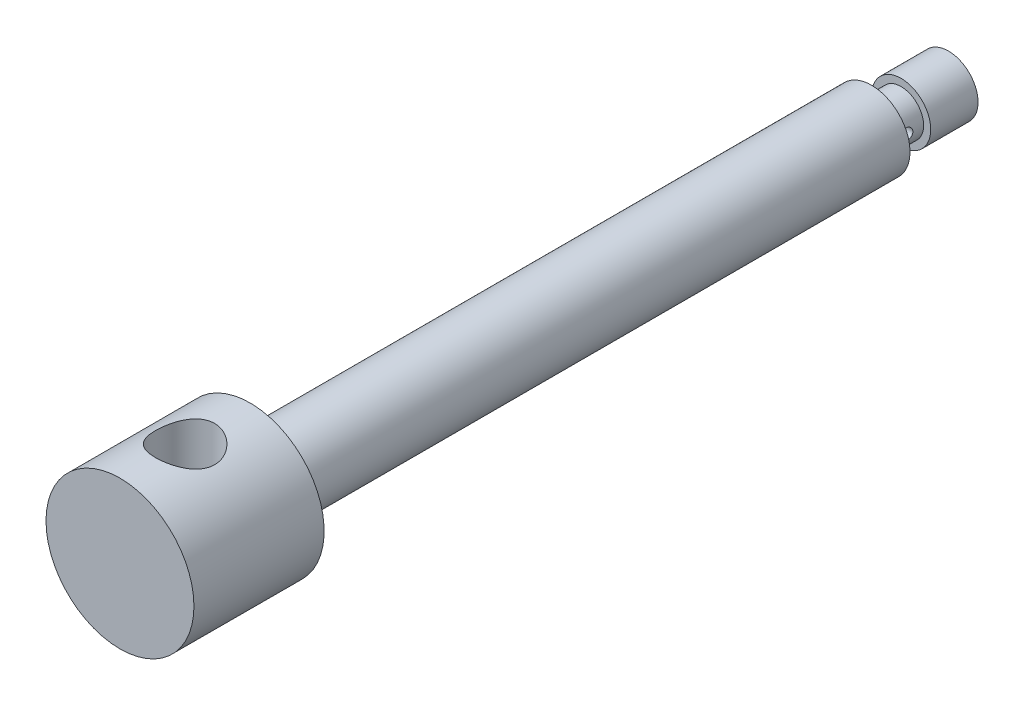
SolidWorks part; units mm, degrees
ref_plane "Front Plane" through (0, 0, 0) normal (0, 0, 1) x (1, 0, 0)
ref_plane "Top Plane" through (0, 0, 0) normal (0, 1, 0) x (1, 0, 0)
ref_plane "Right Plane" through (0, 0, 0) normal (1, 0, 0) x (0, 0, -1)
sketch "Sketch1" plane through (0, 0, 0) normal (0, 0, 1) x (1, 0, 0)
  circle A0 centre (0, 0) radius 12.5
  dimension "D1" = 25
extrude "Boss-Extrude1" add sketch "Sketch1" along normal blind 140
sketch "Sketch2" plane through (0, 0, 0) normal (0, 1, 0) x (1, 0, 0)
  line L0 (0, 0) -> (0, -50000) construction
  line L1 (12.5, 0) -> (-12.5, 0) construction
  line L3 (5, 0) -> (5, -8)
  line L4 (5, -8) -> (3.8, -8)
  line L5 (3.8, -8) -> (3.8, -13)
  line L6 (3.8, -13) -> (6.5, -13)
  line L7 (6.5, -13) -> (6.5, -115)
  line L8 (6.5, -115) -> (3.8, -115)
  line L9 (3.8, -115) -> (3.8, -118)
  line L11 (3.8, -118) -> (14.4791, -118)
  line L12 (14.4791, -118) -> (14.4791, 0)
  line L13 (14.4791, 0) -> (5, 0)
  point P4 (0, 0)
  dimension "D2" = 8
  dimension "D3" = 5
  dimension "D4" = 102
  dimension "D5" = 3
  dimension "D6" = 6.5
  dimension "D7" = 1.2
revolve "Cut-Revolve2" cut sketch "Sketch2" angle 360 about L0
sketch "Sketch3" plane through (0, 0, 0) normal (0, 1, 0) x (1, 0, 0)
  line L0 (-12.5, -140) -> (12.5, -140) construction
  line L1 (0, -129) -> (0, 49871) construction
  line L2 (-12.5, -118) -> (-12.5, -140) construction
  circle A0 centre (0, -129) radius 5
  dimension "D1" = 10
  dimension "D2" = 11
  dimension "D3" = 12.5
extrude "Cut-Extrude1" cut sketch "Sketch3" against normal up to surface and the other way up to surface
sketch "Sketch4" plane through (0, 0, 0) normal (1, 0, 0) x (0, 0, -1)
  line L0 (0, -5) -> (0, 5) construction
  circle A0 centre (-10.81, 0) radius 1
  dimension "D1" = 2
  dimension "D2" = 10.81
  dimension "D3" = 0
extrude "Cut-Extrude2" cut sketch "Sketch4" against normal mid plane 10
